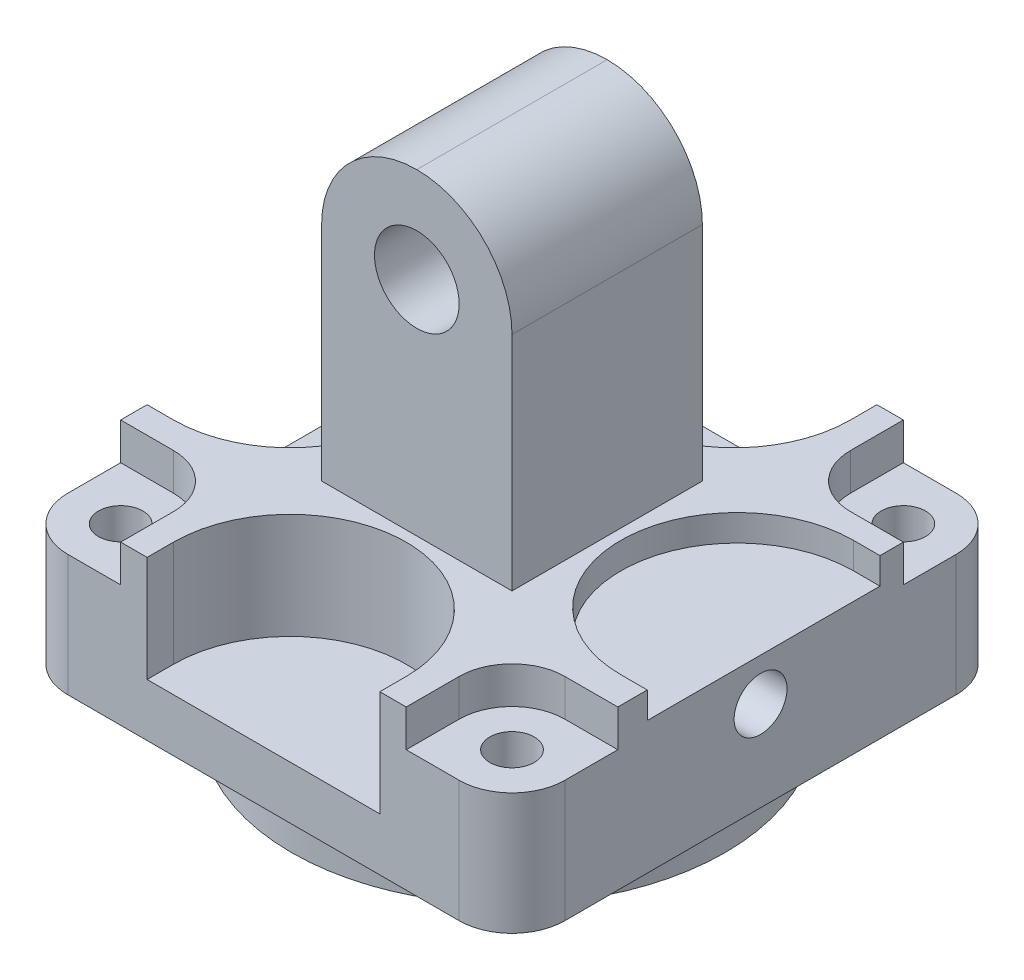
SolidWorks part; units mm, degrees
ref_plane "Plan de face" through (0, 0, 0) normal (0, 0, 1) x (1, 0, 0)
ref_plane "Plan de dessus" through (0, 0, 0) normal (0, 1, 0) x (1, 0, 0)
ref_plane "Plan de droite" through (0, 0, 0) normal (1, 0, 0) x (0, 0, -1)
sketch "Esquisse1" plane through (0, 0, 0) normal (0, 0, 1) x (1, 0, 0)
  line L1 (-23.5, 15) -> (23.5, 15)
  line L2 (-23.5, 15) -> (-23.5, 0)
  line L3 (-23.5, 0) -> (23.5, 0)
  line L4 (23.5, 15) -> (23.5, 0)
  dimension "D1" = 47
  dimension "D2" = 23.5
  dimension "D3" = 15
extrude "Extrusion1" add sketch "Esquisse1" along normal blind 47
sketch "Esquisse2" plane through (0, 0, 0) normal (0, -1, 0) x (1, 0, 0)
  circle A0 centre (0, 23.8473) radius 20.5
  dimension "D1" = 41
extrude "Extrusion2" add sketch "Esquisse2" along normal blind 5
sketch "Esquisse3" plane through (0, -5, 0) normal (0, -1, 0) x (1, 0, 0)
  circle A0 centre (0, 23.8473) radius 9.75
  dimension "D1" = 19.5
extrude "Extrusion3" add sketch "Esquisse3" along normal blind 3.5
sketch "Esquisse9" plane through (0, 15, 0) normal (0, 1, 0) x (-1, 0, 0)
  line L0 (0, -5.7773) -> (0, 143.899) construction
  line L1 (0, 23.5) -> (-77.8064, 23.5) construction
  line L2 (11, 2.5) -> (11, 0)
  line L3 (-11, 2.5) -> (-11, 0)
  line L4 (0, 23.5) -> (84.5721, 23.5) construction
  line L5 (-23.5, 0) -> (23.5, 0) construction
  line L6 (-11, 0) -> (11, 0)
  line L8 (-11, 44.5) -> (-11, 47)
  line L9 (21, 34.5) -> (23.5, 34.5)
  line L10 (-23.5, 47) -> (23.5, 47) construction
  line L11 (23.5, 47) -> (23.5, 0) construction
  line L12 (21, 12.5) -> (23.5, 12.5)
  line L13 (-11, 47) -> (11, 47)
  line L14 (23.5, 12.5) -> (23.5, 34.5)
  line L15 (11, 47) -> (11, 44.5)
  arc A3 (21, 34.5) -> (21, 12.5) centre (21, 23.5) ccw
  arc A4 (11, 2.5) -> (-11, 2.5) centre (0, 2.5) ccw
  arc A5 (-11, 44.5) -> (11, 44.5) centre (0, 44.5) ccw
  dimension "D1" = 22
  dimension "D2" = 22
  dimension "D3" = 22
  dimension "D4" = 2.5
  dimension "D5" = 2.5
  dimension "D6" = 2.5
extrude "Enlèv. mat.-Extru.4" cut sketch "Esquisse9" against normal blind 10
sketch "Esquisse10" plane through (0, 15, 0) normal (0, 1, 0) x (-1, 0, 0)
  line L1 (-20.998, 34.2115) -> (-23.5, 34.2115)
  line L2 (-23.5, 47) -> (-23.5, 0) construction
  line L3 (-20.998, 12.2115) -> (-23.5, 12.2115)
  line L4 (-23.5, 12.2115) -> (-23.5, 34.2115)
  line L5 (22, 23.2115) -> (-54.4829, 23.2115) construction
  arc A2 (-20.998, 12.2115) -> (-20.998, 34.2115) centre (-20.998, 23.2115) ccw
  dimension "D1" = 22
  dimension "D2" = 2.502
extrude "Enlèv. mat.-Extru.5" cut sketch "Esquisse10" against normal blind 2.5
fillet "Congé1" radius 5 4 edges at (-23.5, 7.5, 47) (23.5, 7.5, 47) (23.5, 7.5, 0) (-23.5, 7.5, 0)
sketch "Esquisse12" plane through (0, 15, 0) normal (0, 1, 0) x (-1, 0, 0)
  line L0 (-18.5, -19.8609) -> (-18.5, 147.4969) construction
  line L1 (-77.3053, 42) -> (75.0437, 42) construction
  line L2 (-74.6633, 5) -> (76.041, 5) construction
  line L3 (18.5, -17.0081) -> (18.5, 151.795) construction
  arc A0 (-18.5, 47) -> (-23.5, 42) centre (-18.5, 42) ccw construction
  circle A1 centre (-18.5, 5) radius 2.1
  circle A2 centre (-18.5, 42) radius 2.1
  circle A4 centre (18.5, 42) radius 2.1
  circle A5 centre (18.5, 5) radius 2.1
  arc A7 (18.5, 0) -> (23.5, 5) centre (18.5, 5) ccw construction
  dimension "D5" = 4.2
  dimension "D6" = 4.2
  dimension "D7" = 4.2
  dimension "D8" = 4.2
extrude "Enlèv. mat.-Extru.6" cut sketch "Esquisse12" against normal through all
sketch "Esquisse14" plane through (0, 0, 0) normal (1, 0, 0) x (0, 0, -1)
  line L1 (-29.0973, 11.5) -> (-29.0973, -8.5)
  line L2 (-33.5973, -8.5) -> (-14.0973, -8.5) construction
  line L4 (-29.0973, 11.5) -> (-23.8473, 11.5)
  line L5 (-29.0973, -8.5) -> (-23.8473, -8.5)
  line L6 (-23.8473, 11.5) -> (-23.8473, -8.5)
  dimension "D1" = 5.25
  dimension "D3" = 20
revolve "Enlèvement de matière-Révolution1" cut sketch "Esquisse14" angle 360 about L6
hole_wizard "Trou taraudé M61" positions "Esquisse3D1" profile "Esquisse15" tap size "M6" standard "ISO"
sketch3d "Esquisse3D1"
  point P0 (23.5, 8.5, 23.5)
  point P1 (0, 21.2253, 55.0476)
  point P3 (0, 22.6151, 58.9662)
  point P5 (0, 20.7216, 58.6849)
  dimension "D1" = 23.5
  dimension "D2" = 8.5
sketch "Esquisse15" plane through (23.5, 8.5, 23.5) normal (0, 1, 0) x (0, 0, -1)
  line L0 (0, 0) -> (0, 20.5022)
  line L1 (0, 20.5022) -> (2.5, 19)
  line L2 (2.5, 19) -> (2.5, 0)
  line L5 (2.5, 0) -> (0, 0)
  line L10 (0, 20.5022) -> (-2.5, 19) construction
  line L11 (0, -6.35) -> (0, 107.95) construction
  dimension "Diamètre du trou pour taraudage" = 5
  dimension "Profondeur du trou pour taraudage" = 19
  dimension "Angle de pointe" = 118
sketch "Esquisse16" plane through (0, 15, 0) normal (0, 1, 0) x (1, 0, 0)
  line L0 (18.5, -37) -> (23.5, -37)
  line L1 (23.5, -42) -> (23.5, -34.2115) construction
  line L2 (23.5, -37) -> (23.5, -42)
  line L3 (13.5, -42) -> (13.5, -47)
  line L4 (18.5, -47) -> (11, -47) construction
  line L5 (13.5, -47) -> (18.5, -47)
  line L6 (-13.5, -42) -> (-13.5, -47)
  line L7 (-11, -47) -> (-18.5, -47) construction
  line L8 (-13.5, -47) -> (-18.5, -47)
  line L9 (-18.5, -37) -> (-23.5, -37)
  line L12 (-23.5, -37) -> (-23.5, -42)
  line L13 (18.5, -10) -> (23.5, -10)
  line L14 (23.5, -12.2115) -> (23.5, -5) construction
  line L15 (23.5, -10) -> (23.5, -5)
  line L16 (13.5, -5) -> (13.5, 0)
  line L19 (13.5, 0) -> (18.5, 0)
  line L20 (-13.5, -5) -> (-13.5, 0)
  line L21 (-11, 0) -> (-18.5, 0) construction
  line L22 (-13.5, 0) -> (-18.5, 0)
  line L23 (-18.5, -10) -> (-23.5, -10)
  line L24 (-23.5, -12.5) -> (-23.5, -5) construction
  line L25 (-23.5, -10) -> (-23.5, -5)
  arc A0 (18.5, -47) -> (23.5, -42) centre (18.5, -42) ccw
  arc A1 (18.5, -37) -> (13.5, -42) centre (18.5, -42) ccw
  arc A2 (-13.5, -42) -> (-18.5, -37) centre (-18.5, -42) ccw
  arc A3 (-23.5, -42) -> (-18.5, -47) centre (-18.5, -42) ccw
  arc A4 (23.5, -5) -> (18.5, 0) centre (18.5, -5) ccw
  arc A5 (13.5, -5) -> (18.5, -10) centre (18.5, -5) ccw
  arc A6 (-18.5, 0) -> (-23.5, -5) centre (-18.5, -5) ccw
  arc A7 (-18.5, -10) -> (-13.5, -5) centre (-18.5, -5) ccw
  dimension "D1" = 10
extrude "Extrusion5" cut sketch "Esquisse16" against normal blind 3.5
sketch "Esquisse17" plane through (0, 15, 0) normal (0, 1, 0) x (1, 0, 0)
  line L0 (-18.5, 0) -> (18.5, 0) construction
  line L1 (-9, -14.5) -> (9, -14.5)
  line L2 (-9, -14.5) -> (-9, -32.5)
  line L3 (-9, -32.5) -> (9, -32.5)
  line L4 (9, -14.5) -> (9, -32.5)
  line L5 (11, 0) -> (-11, 0) construction
  point P4 (0, 0)
  dimension "D1" = 18
  dimension "D2" = 9
  dimension "D3" = 18
  dimension "D4" = 14.5
extrude "Extrusion6" add sketch "Esquisse17" along normal blind 30
fillet "Congé2" radius 9 2 edges at (9, 45, 23.5) (-9, 45, 23.5)
sketch "Esquisse18" plane through (0, 0, 32.5) normal (0, 0, 1) x (1, 0, 0)
  circle A0 centre (0, 36) radius 4
  dimension "D1" = 8
extrude "Extrusion7" cut sketch "Esquisse18" against normal through all
